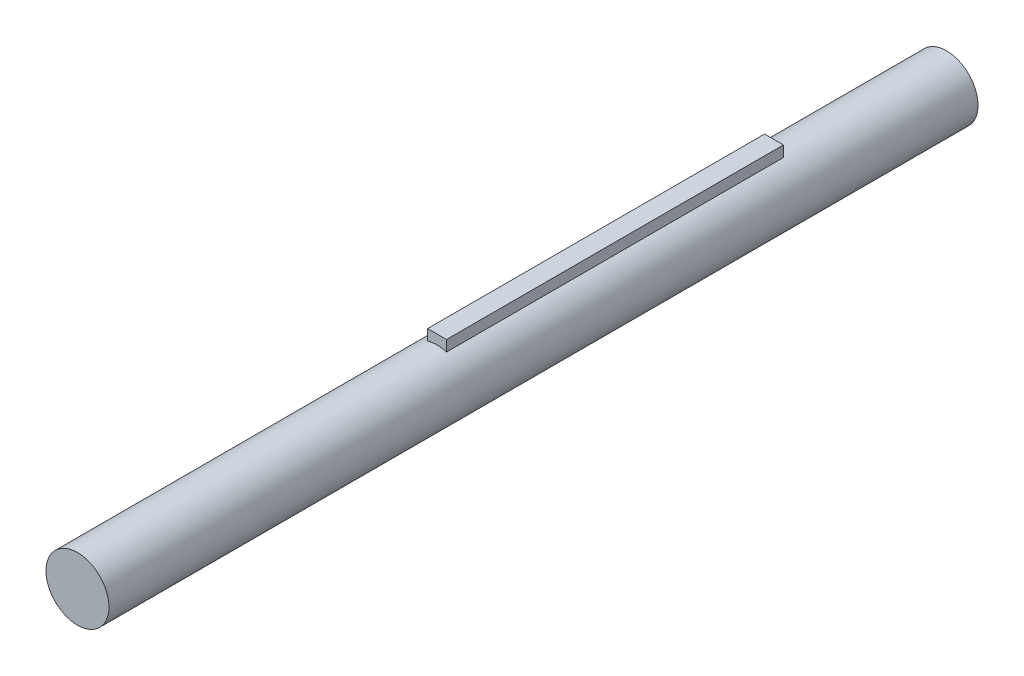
SolidWorks part; units mm, degrees
ref_plane "Front Plane" through (0, 0, 0) normal (0, 0, 1) x (1, 0, 0)
ref_plane "Top Plane" through (0, 0, 0) normal (0, 1, 0) x (1, 0, 0)
ref_plane "Right Plane" through (0, 0, 0) normal (1, 0, 0) x (0, 0, -1)
sketch "Sketch2" plane through (0, 0, 0) normal (0, 0, 1) x (1, 0, 0)
  line L0 (0, 0) -> (0, 32.371) construction
  line L2 (3.81, 16.51) -> (-3.81, 16.51)
  line L3 (3.81, 16.51) -> (3.81, 12.115)
  line L5 (-3.81, 16.51) -> (-3.81, 12.115)
  line L6 (3.81, 16.51) -> (-7.6847, 5.0153) construction
  line L7 (3.9912, 8.7088) -> (-3.81, 16.51) construction
  arc A0 (-3.81, 12.115) -> (3.81, 12.115) centre (0, 0) ccw
  point P3 (0, 12.7)
  dimension "D1" = 25.4
  dimension "D2" = 7.62
  dimension "D3" = 3.81
  dimension "D4" = 3.81
extrude "Boss-Extrude1" add sketch "Sketch2" along normal blind 135.89
sketch "Sketch3" plane through (0, 0, 135.89) normal (0, 0, 1) x (1, 0, 0)
  circle A0 centre (0, 0) radius 12.7
extrude "Boss-Extrude2" add sketch "Sketch3" along normal blind 145.034
sketch "Sketch4" plane through (0, 0, 0) normal (0, 0, -1) x (-1, 0, 0)
  circle A0 centre (0, 0) radius 12.7
extrude "Boss-Extrude3" add sketch "Sketch4" along normal blind 69.596
